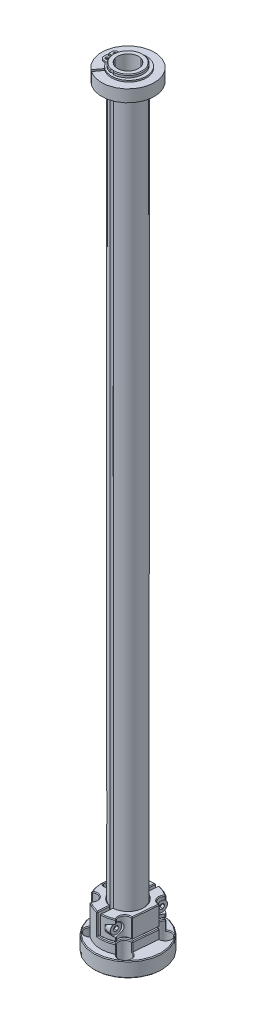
SolidWorks part; units mm, degrees
ref_plane "前视基准面" through (0, 0, 0) normal (0, 0, 1) x (1, 0, 0)
ref_plane "上视基准面" through (0, 0, 0) normal (0, 1, 0) x (1, 0, 0)
ref_plane "右视基准面" through (0, 0, 0) normal (1, 0, 0) x (0, 0, -1)
imported_body "输入1"
sketch "草图1" plane through (0, -132.9922, 0) normal (0, 1, 0) x (1, 0, 0)
  circle A0 centre (-100.5116, -11.4799) radius 2.25 construction
  circle A1 centre (-100.5116, -11.4799) radius 2.25
  circle A2 centre (-98.3101, 13.1707) radius 2.25 construction
  circle A3 centre (-98.3101, 13.1707) radius 2.25
extrude "切除-拉伸1" cut sketch "草图1" against normal through all
